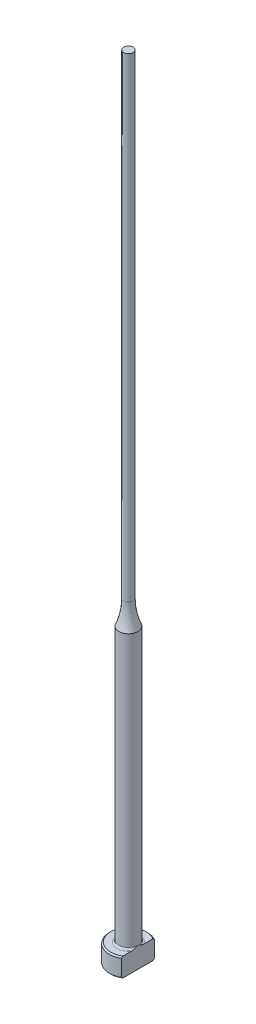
SolidWorks part; units mm, degrees
ref_plane "Front Plane" through (0, 0, 0) normal (0, 0, 1) x (1, 0, 0)
ref_plane "Top Plane" through (0, 0, 0) normal (0, 1, 0) x (1, 0, 0)
ref_plane "Right Plane" through (0, 0, 0) normal (1, 0, 0) x (0, 0, -1)
sketch "Sketch1" plane through (0, 0, 0) normal (0, 0, 1) x (1, 0, 0)
  line L0 (0, 259.9588) -> (0, -15.1925) construction
  line L1 (0, 0) -> (-3, 0)
  line L2 (-3, 0) -> (-3, 3)
  line L3 (-3, 3) -> (-1.5, 3)
  line L4 (-0.75, 50) -> (-0.75, 125)
  line L5 (-0.75, 125) -> (0, 125)
  line L6 (0, 125) -> (0, 0)
  line L7 (-1.5, 3) -> (-1.5, 46.2003)
  arc A0 (-1.5, 46.2003) -> (-0.75, 50) centre (-10.75, 50) ccw
  point P13 (-1.5, 0)
  dimension "D1" = 10
  dimension "L" = 125
  dimension "H" = 6
  dimension "T" = 3
  dimension "D" = 1.5
  dimension "B" = 3
  dimension "S" = 50
revolve "Revolve1" add sketch "Sketch1" angle 360 about L0
chamfer "Chamfer1" distance 0.2 angle 45 2 edges at (0, 3, 3) (0, 0, 3)
fillet "Fillet1" radius 0.3 1 edges at (0, 3, 1.5)
sketch "Sketch2" plane through (0, 0, 0) normal (0, 1, 0) x (1, 0, 0)
  line L0 (1.5, 2.5981) -> (1.5, -2.5981)
  circle A0 centre (0, 0) radius 3 construction
  arc A1 (1.5, -2.5981) -> (1.5, 2.5981) centre (0, 0) ccw
  circle A2 centre (0, 0) radius 1.5 construction
extrude "KEY" cut sketch "Sketch2" along normal through all
